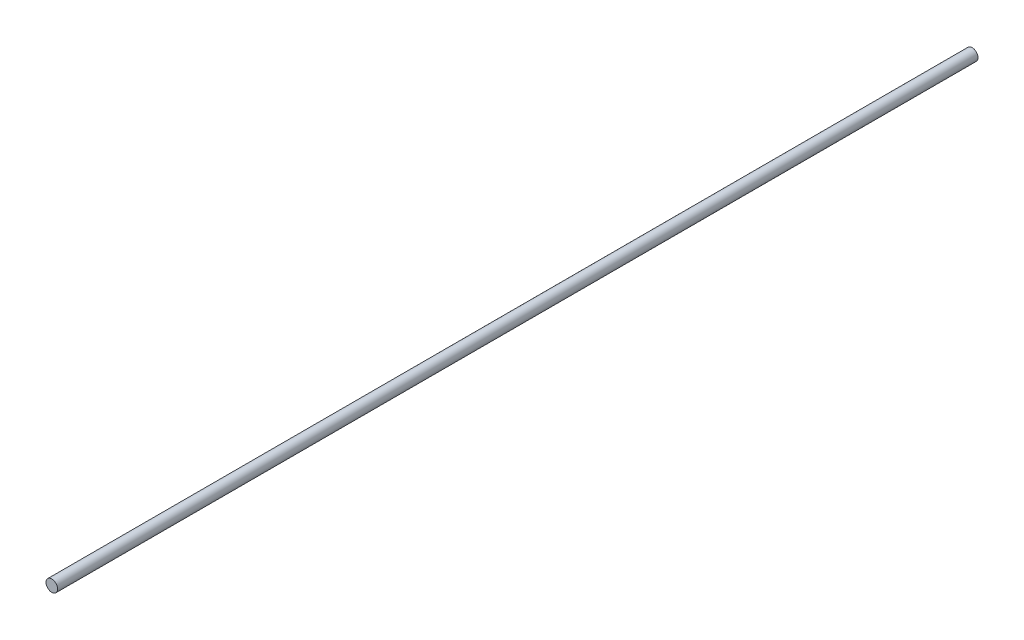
SolidWorks part; units mm, degrees
ref_plane "Front Plane" through (0, 0, 0) normal (0, 0, 1) x (1, 0, 0)
ref_plane "Top Plane" through (0, 0, 0) normal (0, 1, 0) x (1, 0, 0)
ref_plane "Right Plane" through (0, 0, 0) normal (1, 0, 0) x (0, 0, -1)
sketch "Sketch1" plane through (0, 0, 0) normal (0, 0, 1) x (1, 0, 0)
  circle A0 centre (0, 0) radius 30
  dimension "D1" = 60
extrude "Boss-Extrude1" add sketch "Sketch1" against normal blind 4750
